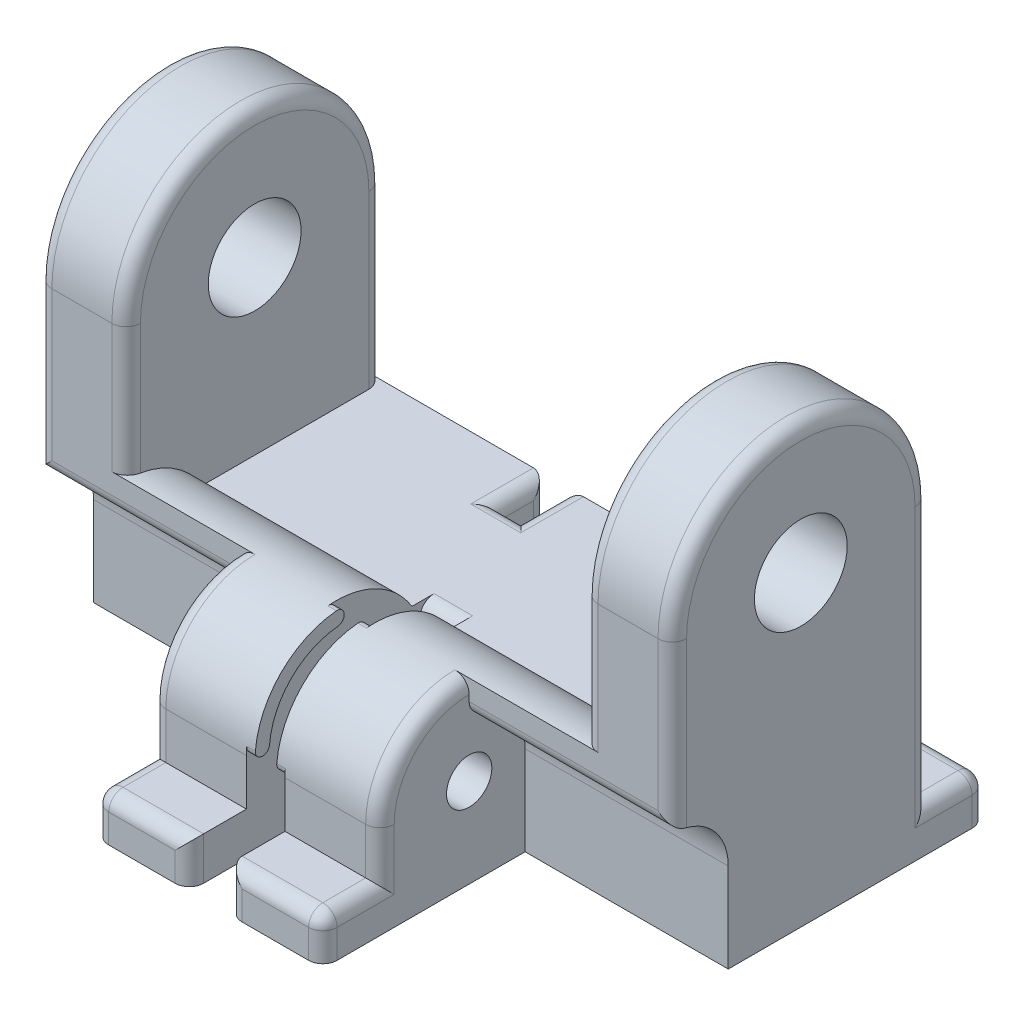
SolidWorks part; units mm, degrees
ref_plane "Front Plane" through (0, 0, 0) normal (0, 0, 1) x (1, 0, 0)
ref_plane "Top Plane" through (0, 0, 0) normal (0, 1, 0) x (1, 0, 0)
ref_plane "Right Plane" through (0, 0, 0) normal (1, 0, 0) x (0, 0, -1)
sketch "values-params_finger" plane through (0, 0, 0) normal (0, 0, 1) x (1, 0, 0)
  line L0 (0, 0) -> (62.5, 0) construction
  line L1 (0, -4.9462) -> (37.5, -4.9462) construction
  line L2 (0, -9.7143) -> (3.36, -9.7143) construction
  line L3 (0, -13.496) -> (4.5602, -13.496) construction
  line L4 (0, -17.4421) -> (12, -17.4421) construction
  line L5 (0, -21.6348) -> (12, -21.6348) construction
  line L6 (0, -25.663) -> (8, -25.663) construction
  line L7 (0, -29.4447) -> (8, -29.4447) construction
  line L8 (0, -32.88) -> (18, -32.88) construction
  line L9 (0, -36.2915) -> (31.75, -36.2915) construction
  line L10 (0, -39.8857) -> (22.75, -39.8857) construction
  line L11 (0, -43.8499) -> (22.75, -43.8499) construction
  line L12 (0, -47.895) -> (4.5, -47.895) construction
  line L13 (0, -51.6975) -> (15, -51.6975) construction
  line L14 (0, -55.9037) -> (15, -55.9037) construction
  line L15 (0, -61.7021) -> (44.45, -61.7021) construction
  dimension "Lp" = 62.5
  dimension "Ld" = 37.5
  dimension "Kp" = 3.36
  dimension "Kd" = 4.5602
  dimension "Kp Length" = 12
  dimension "Kd Length" = 12
  dimension "Rp" = 8
  dimension "Rd" = 8
  dimension "height" = 18
  dimension "depth" = 31.75
  dimension "Lb" = 22.75
  dimension "Lb Pivot" = 22.75
  dimension "pad thickness" = 4.5
  dimension "Tp" = 15
  dimension "Td" = 15
  dimension "base depth" = 44.45
inserted part "params_finger"
sketch "values-params_print" plane through (0, 0, 0) normal (0, 0, 1) x (1, 0, 0)
  line L0 (0, 0) -> (0.7, 0) construction
  line L1 (0, -5.2349) -> (3, -5.2349) construction
  line L2 (0, -10.104) -> (4, -10.104) construction
  line L3 (0, -15.1093) -> (100, -15.1093) construction
  line L4 (0, -19.837) -> (0.15, -19.837) construction
  line L5 (0, -24.2596) -> (0.3, -24.2596) construction
  line L6 (0, -28.606) -> (3.175, -28.606) construction
  line L7 (0, -33.0286) -> (9.5, -33.0286) construction
  line L8 (0, -37.6038) -> (2.4, -37.6038) construction
  line L9 (0, -43.1661) -> (6.35, -43.1661) construction
  dimension "width destroy" = 0.7
  dimension "width keep" = 3
  dimension "width tab" = 4
  dimension "base diameter" = 100
  dimension "print fit" = 0.15
  dimension "print free" = 0.3
  dimension "pin diameter" = 3.175
  dimension "pulley diameter" = 9.5
  dimension "pulley thickness" = 2.4
  dimension "base pin diameter" = 6.35
inserted part "params_print"
sketch "Sketch1" plane through (0, 0, 0) normal (1, 0, 0) x (0, 0, -1)
  line L0 (0, 0) -> (39.0226, 0) construction
  line L1 (0, 0) -> (0, 6.25) construction
  line L2 (-6.25, 6.25) -> (-6.25, 0) construction
  line L3 (-10.25, 0) -> (22, 0)
  line L4 (-10.25, 0) -> (-10.25, 3)
  line L5 (-10.25, 3) -> (-6.25, 3)
  line L6 (-6.25, 3) -> (-6.25, 6.25)
  line L7 (-6.25, 0) -> (0, 0) construction
  line L8 (0, 12.5) -> (18.6083, 12.5) construction
  line L9 (52.3127, 6) -> (-34.6817, 6) construction
  line L10 (0, 21.5) -> (0, 12.5)
  line L12 (18, 21.5) -> (18, 3)
  line L13 (18, 3) -> (22, 3)
  line L14 (22, 3) -> (22, 0)
  line L15 (-4.75, 6.25) -> (-4.75, 26.7415) construction
  circle A0 centre (0, 6.25) radius 1.5875
  circle A1 centre (0, 6.25) radius 4.75 construction
  circle A2 centre (0, 6.25) radius 6.25 construction
  circle A3 centre (9, 21.5) radius 9 construction
  circle A4 centre (9, 21.5) radius 3.25
  arc A5 (18, 21.5) -> (0, 21.5) centre (9, 21.5) ccw
  arc A6 (-6.25, 6.25) -> (0, 12.5) centre (0, 6.25) cw
  dimension "D1" = 3.175
  dimension "D2" = 9.5
  dimension "D3" = 12.5
  dimension "D6" = 6.5
  dimension "D7" = 18
  dimension "D8" = 6
  dimension "D9" = 22.75
  dimension "D4" = 3
  dimension "D5" = 4
extrude "Main Body" add sketch "Sketch1" along normal mid plane 44.45
sketch "Sketch2" plane through (0, 0, 0) normal (1, 0, 0) x (0, 0, -1)
  line L0 (-6.25, 6.25) -> (-6.25, 3) construction
  line L1 (-6.25, 3) -> (-10.25, 3) construction
  line L2 (-10.25, 3) -> (-10.25, 0) construction
  line L3 (-10.25, 0) -> (22, 0) construction
  line L4 (-6.25, 6.25) -> (-6.25, 3)
  line L5 (-6.25, 3) -> (-10.25, 3)
  line L6 (-10.25, 3) -> (-10.25, 0)
  line L7 (-10.25, 0) -> (6.25, 0)
  line L8 (6.25, 6.25) -> (6.25, 0)
  arc A1 (0, 12.5) -> (-6.25, 6.25) centre (0, 6.25) ccw construction
  arc A2 (0, 12.5) -> (6.25, 6.25) centre (0, 6.25) cw
  arc A3 (0, 12.5) -> (-6.25, 6.25) centre (0, 6.25) ccw
extrude "Pulley Clearance" cut sketch "Sketch2" against normal mid plane 2.7
sketch "Sketch3" plane through (0, 0, 0) normal (1, 0, 0) x (0, 0, -1)
  line L1 (0, 21.5) -> (0, 12.5) construction
  line L2 (0, 21.5) -> (0, 12.5)
  line L5 (18, 3) -> (18, 21.5) construction
  line L6 (18, 9.5) -> (18, 21.5)
  line L7 (5.3385, 9.5) -> (18, 9.5)
  circle A0 centre (0, 6.25) radius 4.75 construction
  arc A1 (18, 21.5) -> (0, 21.5) centre (9, 21.5) ccw construction
  arc A2 (18, 21.5) -> (0, 21.5) centre (9, 21.5) ccw
  arc A3 (0, 12.5) -> (5.3385, 9.5) centre (0, 6.25) cw
  dimension "D1" = 9.5
  dimension "D2" = 3
extrude "Finger Clearance" cut sketch "Sketch3" against normal mid plane 31.75
sketch "Sketch7" plane through (22.225, 0, 0) normal (1, 0, 0) x (0, 0, -1)
  line L0 (-6.25, 6.25) -> (-6.25, 3) construction
  line L1 (-6.25, 3) -> (-10.25, 3) construction
  line L2 (-10.25, 3) -> (-10.25, 0) construction
  line L3 (-6.25, 6.25) -> (-6.25, 3)
  line L4 (-6.25, 3) -> (-10.25, 3)
  line L5 (-10.25, 3) -> (-10.25, 0)
  line L6 (0, 12.5) -> (0, 0)
  line L7 (0, 0) -> (-10.25, 0)
  line L8 (-6.25, 6.25) -> (6.25, 6.25) construction
  arc A0 (0, 12.5) -> (-6.25, 6.25) centre (0, 6.25) ccw construction
  arc A1 (0, 12.5) -> (-6.25, 6.25) centre (0, 6.25) ccw
extrude "Side Clearance 1" cut sketch "Sketch7" against normal blind 14.225
sketch "Sketch8" plane through (-22.225, 0, 0) normal (-1, 0, 0) x (0, 0, 1)
  line L0 (6.25, 6.25) -> (6.25, 3) construction
  line L1 (6.25, 3) -> (10.25, 3) construction
  line L2 (10.25, 3) -> (10.25, 0) construction
  line L3 (6.25, 6.25) -> (6.25, 3)
  line L4 (6.25, 3) -> (10.25, 3)
  line L5 (10.25, 3) -> (10.25, 0)
  line L6 (0, 12.5) -> (0, 0)
  line L7 (0, 0) -> (10.25, 0)
  arc A0 (6.25, 6.25) -> (0, 12.5) centre (0, 6.25) ccw construction
  arc A1 (6.25, 6.25) -> (0, 12.5) centre (0, 6.25) ccw
extrude "Side Clearance 2" cut sketch "Sketch8" against normal blind 14.23
sketch "Sketch9" plane through (8, 0, 0) normal (1, 0, 0) x (0, 0, -1)
  line L0 (-3.9188, 6.25) -> (-6.25, 6.25) construction
  line L1 (0, 7.8375) -> (0, 10.1688) construction
  line L2 (3.9188, 6.25) -> (3.9188, 0)
  line L3 (3.9188, 0) -> (-3.9188, 0)
  line L4 (0, 0) -> (-10.25, 0) construction
  line L5 (-3.9188, 0) -> (-3.9188, 6.25)
  arc A0 (3.9188, 6.25) -> (-3.9188, 6.25) centre (0, 6.25) ccw
extrude "Side Pulley Clearance 1" cut sketch "Sketch9" along normal up to surface (14.225 mm away)
sketch "Sketch10" plane through (-7.995, 0, 0) normal (-1, 0, 0) x (0, 0, 1)
  line L0 (-3.9188, 6.25) -> (-3.9188, 0)
  line L1 (-3.9188, 0) -> (3.9188, 0)
  line L2 (0, 0) -> (10.25, 0) construction
  line L3 (3.9188, 0) -> (3.9188, 6.25)
  arc A0 (3.9188, 6.25) -> (-3.9188, 6.25) centre (0, 6.25) ccw
  arc A1 (0, 10.1688) -> (-3.9188, 6.25) centre (0, 6.25) ccw construction
extrude "Side Pulley Clearance 2" cut sketch "Sketch10" along normal up to surface (14.23 mm away)
sketch "Sketch11" plane through (0, 0, 0) normal (1, 0, 0) x (0, 0, -1)
  line L0 (5.3385, 9.5) -> (18, 9.5) construction
  line L1 (18, 9.5) -> (18, 21.5) construction
  line L2 (0, 21.5) -> (0, 12.5) construction
  line L3 (5.3385, 9.5) -> (18, 9.5)
  line L4 (18, 9.5) -> (18, 21.5)
  line L5 (0, 21.5) -> (0, 12.5)
  arc A0 (5.3385, 9.5) -> (0, 12.5) centre (0, 6.25) ccw construction
  arc A1 (18, 21.5) -> (0, 21.5) centre (9, 21.5) ccw construction
  arc A2 (5.3385, 9.5) -> (0, 12.5) centre (0, 6.25) ccw
  arc A3 (18, 21.5) -> (0, 21.5) centre (9, 21.5) ccw
extrude "Finger Print Clearance" cut sketch "Sketch11" against normal mid plane 32.05
sketch "Sketch12" plane through (0, 0, 0) normal (1, 0, 0) x (0, 0, -1)
  line L0 (-6.25, 6.25) -> (-5.25, 6.25)
  line L1 (0, 12.5) -> (0, 11.5)
  arc A0 (0, 12.5) -> (-6.25, 6.25) centre (0, 6.25) ccw
  arc A1 (5.3385, 9.5) -> (-6.25, 6.25) centre (0, 6.25) ccw construction
  arc A2 (0, 11.5) -> (-5.25, 6.25) centre (0, 6.25) ccw
  dimension "D1" = 1
extrude "Pully Cover" add sketch "Sketch12" along normal up to surface and the other way up to surface
sketch "Sketch13" plane through (0, 0, 0) normal (0, -1, 0) x (1, 0, 0)
  line L0 (0, 0) -> (0, -6.25) construction
  line L1 (-1.35, -6.25) -> (1.35, -6.25) construction
  line L3 (0.75, 0) -> (-0.75, 0)
  line L4 (0.75, 0) -> (0.75, 10.25)
  line L5 (0.75, 10.25) -> (-0.75, 10.25)
  line L6 (-0.75, 0) -> (-0.75, 10.25)
  dimension "D1" = 1.5
extrude "Pully Cover Cutaway" cut sketch "Sketch13" against normal through all
fillet "Pulley Cover Fillet" radius 0.5 6 edges at (1.05, 11.5, 0) (1.05, 12.5, 0) (-1.05, 11.5, 0) (1.05, 6.25, 5.25) (1.05, 6.25, 6.25) (-1.05, 6.25, 5.25)
sketch "Sketch15" plane through (0, 0, -18) normal (0, 0, -1) x (-1, 0, 0)
  line L0 (0, 0) -> (0, 9.5) construction
  line L1 (16.025, 9.5) -> (-16.025, 9.5) construction
  line L3 (4.5, 9.5) -> (3, 9.5)
  line L4 (4.5, 9.5) -> (4.5, 6)
  line L5 (4.5, 6) -> (3, 6)
  line L6 (3, 9.5) -> (3, 6)
  dimension "D1" = 6
  dimension "D2" = 3
  dimension "D3" = 1.5
revolve "Torsion Spring Notches" cut sketch "Sketch15" angle 360
fillet "Contouring" radius 1 38 edges at (-22.225, 12.25, -18) (8, 1.5, 10.25) (8, 3, 8.25) (8, 4.625, 6.25) (-22.225, 3, -20) (-22.225, 1.5, -22) (-7.995, 10.6694, 4.4194) (-7.995, 4.625, 6.25) (-7.995, 3, 8.25) (-7.995, 1.5, 10.25) (15.1125, 10.1688, 0) (0, 3, -22) (-15.11, 10.1688, 0) (22.225, 1.5, -22) (-16.025, 17, 0) (-16.025, 30.5, -9) (-16.025, 15.5, -18) (16.025, 15.5, -18) (16.025, 30.5, -9) (16.025, 17, 0) (22.225, 3, -20) (22.225, 12.25, -18) (22.225, 30.5, -9) (22.225, 15.8344, 0) (-3, 9.5, -16.25) (-3.75, 9.5, -14.5) (-4.5, 9.5, -16.25) (-4.5, 7.75, -18) (-3.75, 6, -18) (-3, 7.75, -18) (-4.6725, 3, 10.25) (-1.35, 1.5, 10.25) (1.35, 1.5, 10.25) (0, 9.5, -5.3385) (-22.225, 15.8344, 0) (4.675, 3, 10.25) (-22.225, 30.5, -9) (8, 10.6694, 4.4194)
ref_point "Ref Center"
equation "\"D1@Sketch1\" = \"pin diameter@values@params_print.sldprt\""
equation "\"D2@Sketch1\" = \"pulley diameter@values@params_print.sldprt\""
equation "\"D3@Sketch1\" = \"pulley diameter@values@params_print.sldprt\" + \"width keep@values@params_print.sldprt\""
equation "\"D7@Sketch1\" = \"height@values@params_finger.sldprt\""
equation "\"D4@Sketch1\" = \"width keep@values@params_print.sldprt\""
equation "\"D5@Sketch1\" = \"width tab@values@params_print.sldprt\""
equation "\"D8@Sketch1\" = 2 * \"width keep@values@params_print.sldprt\""
equation "\"D1@Pulley Clearance\" = \"pulley thickness@values@params_print.sldprt\" + \"print free@values@params_print.sldprt\""
equation "\"D1@Sketch3\" = \"pulley diameter@values@params_print.sldprt\""
equation "\"D1@Finger Clearance\" = \"depth@values@params_finger.sldprt\""
equation "\"D2@Sketch3\" = \"width keep@values@params_print.sldprt\""
equation "\"D9@Sketch1\" = \"LB pivot@values@params_finger.sldprt\""
equation "\"D1@Finger Print Clearance\" = \"depth@values@params_finger.sldprt\" + \"print free@values@params_print.sldprt\""
equation "\"D1@Sketch15\" = 2 * \"width keep@values@params_print.sldprt\""
equation "\"D2@Sketch15\" = \"width keep@values@params_print.sldprt\""
equation "\"D1@Main Body\" = \"base depth@values@params_finger.sldprt\""
equation "\"D1@Side Clearance 1\" = ( \"base depth@values@params_finger.sldprt\" - 16 ) / 2"
